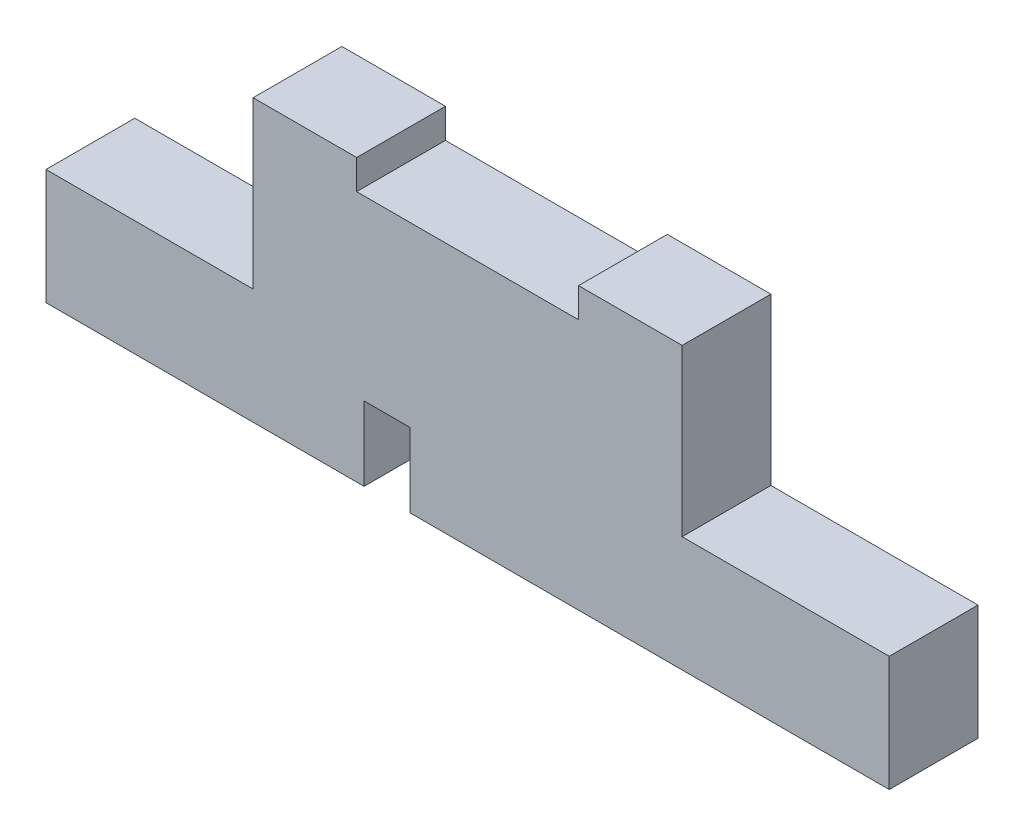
SolidWorks part; units mm, degrees
ref_plane "Plan de face" through (0, 0, 0) normal (0, 0, 1) x (1, 0, 0)
ref_plane "Plan de dessus" through (0, 0, 0) normal (0, 1, 0) x (1, 0, 0)
ref_plane "Plan de droite" through (0, 0, 0) normal (1, 0, 0) x (0, 0, -1)
sketch "Esquisse1" plane through (0, 0, 0) normal (0, 0, 1) x (1, 0, 0)
  line L0 (-33.4377, 0) -> (41.7492, 0) construction
  line L1 (-32.4148, 7.8) -> (40.7262, 7.8) construction
  line L2 (0, 15.9836) -> (0, -12.7869) construction
  line L3 (35.5, 17.1344) -> (35.5, -19.4361) construction
  line L4 (-21.5, 13.682) -> (-21.5, -11.3803) construction
  line L5 (3.1, 5.4984) -> (3.1, -6.0098) construction
  line L6 (-4.4115, 5) -> (7.4803, 5) construction
  line L7 (-7.5, 26.5967) -> (-7.5, 4) construction
  line L8 (21.5, 29.7934) -> (21.5, 5.4984) construction
  line L9 (-32.4148, 19) -> (44.0508, 19) construction
  line L10 (-21.5, 0) -> (0, 0)
  line L11 (0, 0) -> (0, 5)
  line L12 (0, 5) -> (3.1, 5)
  line L13 (3.1, 5) -> (3.1, 0)
  line L14 (35.5, 0) -> (3.1, 0)
  line L15 (35.5, 0) -> (35.5, 7.8)
  line L16 (35.5, 7.8) -> (21.5, 7.8)
  line L17 (21.5, 7.8) -> (21.5, 19)
  line L18 (21.5, 19) -> (-7.5, 19)
  line L19 (-7.5, 19) -> (-7.5, 7.8)
  line L20 (-7.5, 7.8) -> (-21.5, 7.8)
  line L21 (-21.5, 7.8) -> (-21.5, 0)
  dimension "D1" = 7.8
  dimension "D2" = 35.5
  dimension "D3" = 57
  dimension "D4" = 3.1
  dimension "D5" = 5
  dimension "14" = 14
  dimension "D7" = 14
  dimension "D8" = 19
extrude "Boss.-Extru.1" add sketch "Esquisse1" along normal blind 6
sketch "Esquisse2" plane through (0, 0, 6) normal (0, 0, 1) x (1, 0, 0)
  line L0 (21.5, 19) -> (-7.5, 19) construction
  line L1 (-0.5, 21) -> (14.5, 21)
  line L2 (-0.5, 21) -> (-0.5, 17)
  line L3 (-0.5, 17) -> (14.5, 17)
  line L4 (14.5, 21) -> (14.5, 17)
  line L5 (-0.5, 21) -> (14.5, 17) construction
  line L6 (-0.5, 17) -> (14.5, 21) construction
  point P0 (7, 19)
  dimension "D1" = 4
  dimension "D2" = 15
extrude "Enlèv. mat.-Extru.1" cut sketch "Esquisse2" against normal through all
